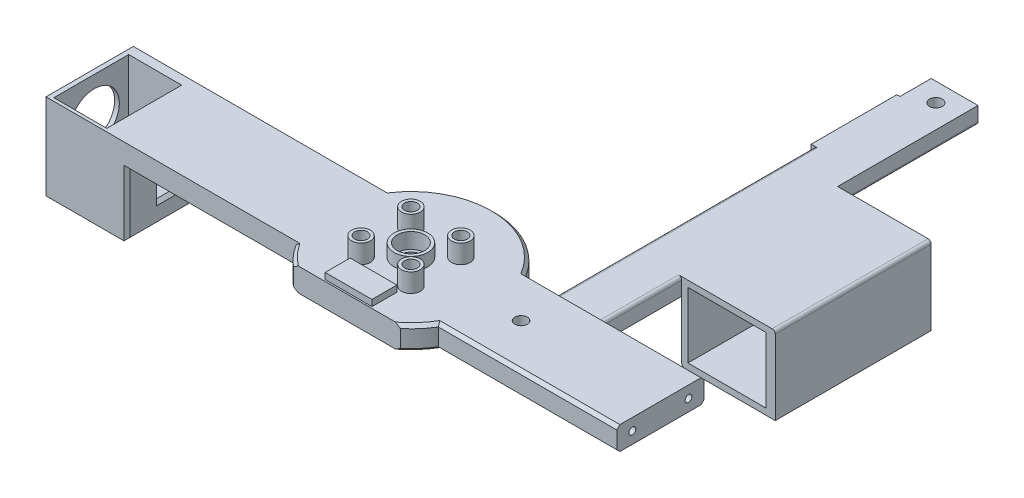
SolidWorks part; units mm, degrees
ref_plane "前视基准面" through (0, 0, 0) normal (0, 0, 1) x (1, 0, 0)
ref_plane "上视基准面" through (0, 0, 0) normal (0, 1, 0) x (1, 0, 0)
ref_plane "右视基准面" through (0, 0, 0) normal (1, 0, 0) x (0, 0, -1)
sketch "草图3" plane through (0, 0, 0) normal (0, 1, 0) x (1, 0, 0)
  line L0 (22.8017, 14) -> (50, 14)
  line L1 (-50, -14) -> (-22.8017, -14)
  line L3 (-50, 14) -> (-22.8017, 14)
  line L5 (-50, -14) -> (50, 14) construction
  line L6 (-50, 14) -> (50, -14) construction
  line L7 (22.8017, -14) -> (50, -14)
  line L9 (-50, 14) -> (-85, 14)
  line L10 (-50, -14) -> (-85, -14)
  line L11 (-85, 14) -> (-85, -14)
  line L13 (-85, 14) -> (-74.296, 14)
  line L14 (-85, 14) -> (-85, -14)
  line L15 (-85, -14) -> (-74.296, -14)
  line L17 (50, 14) -> (80, 14)
  line L19 (50, -14) -> (80, -14)
  line L24 (80, 14) -> (80, -14)
  arc A0 (-22.8017, -14) -> (22.8017, -14) centre (0, 0) ccw
  arc A1 (22.8017, 14) -> (-22.8017, 14) centre (0, 0) ccw
extrude "凸台-拉伸1" add sketch "草图3" along normal blind 7.5 contours L9 L3 A1 L0 L17 L24 L19 L7 A0 L1 L10 L11
sketch "草图4" plane through (0, 0, 0) normal (0, -1, 0) x (1, 0, 0)
  line L0 (-22.8017, -14) -> (-85, -14) construction
  line L1 (-85, 14) -> (-77, 14)
  line L2 (-85, 14) -> (-85, -14)
  line L3 (-85, -14) -> (-77, -14)
  line L4 (-77, 14) -> (-77, -14)
  dimension "D1" = 8
extrude "凸台-拉伸2" add sketch "草图4" along normal blind 20
sketch "草图7" plane through (-77, 0, 0) normal (1, 0, 0) x (0, 0, -1)
  line L0 (-3.5, -8.5) -> (3.5, -8.5)
  line L1 (-3.5, -8.5) -> (-3.5, -13.5)
  line L2 (3.5, -8.5) -> (3.5, -13.5)
  line L3 (-3.5, -13.5) -> (3.5, -13.5)
  line L4 (14, 0) -> (-14, 0) construction
  dimension "D1" = 8.5
  dimension "D2" = 5
extrude "切除-拉伸1" cut sketch "草图7" against normal blind 5
sketch "草图8" plane through (0, 7.5, 0) normal (0, 1, 0) x (1, 0, 0)
  circle A0 centre (0, 0) radius 4.4
extrude "切除-拉伸2" cut sketch "草图8" against normal blind 1 contours A0
sketch "草图9" plane through (0, 6.5, 0) normal (0, 1, 0) x (1, 0, 0)
  circle A0 centre (0, 0) radius 3.4
extrude "切除-拉伸3" cut sketch "草图9" against normal blind 8
sketch "草图14" plane through (80, 0, 0) normal (1, 0, 0) x (0, 0, -1)
  line L0 (0, 7.5) -> (0, 0)
  line L1 (14, 7.5) -> (-14, 7.5) construction
  line L2 (14, 0) -> (-14, 0) construction
  circle A0 centre (-9, 3.75) radius 1.1
  circle A1 centre (9, 3.75) radius 1.1
chamfer "倒角1" distance 1 angle 45 17 edges at (-49.9009, 0, -14) (0, 0, -26.7566) (51.4009, 0, -14) (51.4009, 0, 14) (0, 0, 26.7566) (-49.9009, 0, 14) (0, 7.5, 26.7566) (51.4009, 7.5, 14) (51.4009, 7.5, -14) (0, 7.5, -26.7566) (-77, -10, 14) (-77, -20, 0) (-77, -10, -14) (-77, -13.5, 0) (-77, -11, -3.5) (-77, -11, 3.5) (-77, -8.5, 0)
extrude "切除-拉伸6" cut sketch "草图14" against normal blind 4 contours A1 | A0
sketch "草图15" plane through (0, 0, 0) normal (0, -1, 0) x (1, 0, 0)
  circle A2 centre (-17, 0) radius 2
extrude "凸台-拉伸3" add sketch "草图15" along normal blind 2.5
sketch "草图16" plane through (0, 7.5, 0) normal (0, 1, 0) x (1, 0, 0)
  line L1 (-8, -8) -> (8, -8)
  line L2 (-8, -8) -> (-8, 8)
  line L3 (-8, 8) -> (8, 8)
  line L4 (8, -8) -> (8, 8)
  line L5 (-8, -8) -> (8, 8) construction
  line L6 (-8, 8) -> (8, -8) construction
  point P0 (0, 0)
  dimension "D1" = 16
  dimension "D2" = 16
sketch "草图17" plane through (0, 7.5, 0) normal (0, 1, 0) x (1, 0, 0)
  circle A0 centre (8, 8) radius 2.05
  circle A1 centre (-8, 8) radius 2.05
  circle A2 centre (-8, -8) radius 2.05
  circle A3 centre (8, -8) radius 2.05
  circle A4 centre (-8, 8) radius 3
  circle A5 centre (8, 8) radius 3
  circle A6 centre (-8, -8) radius 3
  circle A7 centre (8, -8) radius 3
extrude "凸台-拉伸4" add sketch "草图17" along normal blind 6
sketch "草图18" plane through (0, 7.5, 0) normal (0, 1, 0) x (1, 0, 0)
  circle A0 centre (0, 0) radius 4.4
  circle A1 centre (0, 0) radius 5.4
extrude "凸台-拉伸5" add sketch "草图18" along normal blind 4
sketch "草图19" plane through (0, 7.5, 0) normal (0, 1, 0) x (1, 0, 0)
  circle A0 centre (35.3025, 0) radius 2
extrude "切除-拉伸7" cut sketch "草图19" against normal blind 6
sketch "草图20" plane through (0, 7.5, 0) normal (0, 1, 0) x (1, 0, 0)
  line L1 (-7.5, -12) -> (7.5, -12)
  line L2 (-7.5, -12) -> (-7.5, -20)
  line L3 (-7.5, -20) -> (7.5, -20)
  line L4 (7.5, -12) -> (7.5, -20)
  line L5 (-7.5, -12) -> (7.5, -20) construction
  line L6 (-7.5, -20) -> (7.5, -12) construction
  point P0 (0, -16)
  dimension "D1" = 15
  dimension "D2" = 8
  dimension "D3" = 0
sketch "草图25" plane through (-85, 0, 0) normal (-1, 0, 0) x (0, 0, 1)
  line L0 (-14, 7.5) -> (14, 7.5) construction
  line L1 (14, 7.5) -> (14, -20) construction
  circle A0 centre (0, -4.5) radius 2.1
  dimension "D1" = 12
  dimension "D2" = 14
extrude "切除-拉伸9" cut sketch "草图25" against normal blind 5
sketch "草图26" plane through (-85, 0, 0) normal (-1, 0, 0) x (0, 0, 1)
  line L1 (-14, 7.5) -> (14, 7.5)
  line L2 (-14, 7.5) -> (-14, -20)
  line L3 (-14, -20) -> (14, -20)
  line L4 (14, 7.5) -> (14, -20)
extrude "凸台-拉伸10" add sketch "草图26" along normal blind 18
sketch "草图28" plane through (0, 0, -14) normal (0, 0, -1) x (-1, 0, 0)
  line L0 (103, 7.5) -> (21.6195, 7.5) construction
  line L1 (84.5, 7.5) -> (101.5, 7.5)
  line L2 (84.5, 7.5) -> (84.5, -20)
  line L3 (84.5, -20) -> (101.5, -20)
  line L4 (101.5, 7.5) -> (101.5, -20)
  line L5 (103, -20) -> (78, -20) construction
  line L6 (103, 7.5) -> (103, -20) construction
  dimension "D1" = 17
  dimension "D2" = 1.5
extrude "切除-拉伸10" cut sketch "草图28" against normal blind 27
sketch "草图29" plane through (-103, 0, 0) normal (-1, 0, 0) x (0, 0, 1)
  line L0 (14, -20) -> (14, 7.5) construction
  line L1 (14, 7.5) -> (-14, 7.5) construction
  circle A0 centre (0, -4.5) radius 8
  dimension "D1" = 14
  dimension "D2" = 12
extrude "切除-拉伸11" cut sketch "草图29" against normal blind 3
sketch "草图42" plane through (0, 7.5, 0) normal (0, 1, 0) x (1, 0, 0)
  line L1 (-29.8362, -32.5182) -> (33.5963, -32.5182)
  line L2 (-29.8362, -32.5182) -> (-29.8362, -20.5182)
  line L3 (-29.8362, -20.5182) -> (33.5963, -20.5182)
  line L4 (33.5963, -32.5182) -> (33.5963, -20.5182)
extrude "切除-拉伸15" cut sketch "草图42" against normal blind 10
sketch "草图43" plane through (-84.5, 0, 0) normal (-1, 0, 0) x (0, 0, 1)
  line L0 (-14, -20) -> (14, -20) construction
  line L1 (-14, 7.5) -> (-11, 7.5)
  line L2 (-14, 7.5) -> (-14, -20)
  line L3 (-14, -20) -> (-11, -20)
  line L4 (-11, 7.5) -> (-11, -20)
  dimension "D1" = 3
extrude "凸台-拉伸16" add sketch "草图43" along normal blind 18.5
sketch "草图44" plane through (0, 0, -14) normal (0, 0, -1) x (-1, 0, 0)
  line L1 (-47.8017, 6.5) -> (-32.8017, 6.5)
  line L2 (-47.8017, 6.5) -> (-47.8017, 1)
  line L3 (-47.8017, 1) -> (-32.8017, 1)
  line L4 (-32.8017, 6.5) -> (-32.8017, 1)
  line L5 (-80, 1) -> (-22.8017, 1) construction
  line L7 (-22.8017, 6.5) -> (-22.8017, 1) construction
  dimension "D1" = 10
  dimension "D2" = 15
extrude "凸台-拉伸17" add sketch "草图44" along normal blind 120
sketch "草图45" plane through (47.8017, 0, 0) normal (1, 0, 0) x (0, 0, -1)
  line L0 (134, 6.5) -> (14, 6.5) construction
  line L1 (39, 6.5) -> (89, 6.5)
  line L2 (39, 6.5) -> (39, -18.5)
  line L3 (39, -18.5) -> (89, -18.5)
  line L4 (89, 6.5) -> (89, -18.5)
  line L5 (14, 6.5) -> (14, 1) construction
  dimension "D1" = 50
  dimension "D2" = 25
  dimension "D3" = 25
extrude "凸台-拉伸18" add sketch "草图45" along normal blind 30
sketch "草图46" plane through (0, 0, -39) normal (0, 0, 1) x (1, 0, 0)
  line L0 (77.8017, 6.5) -> (77.8017, -18.5) construction
  line L1 (74.8017, -16.5) -> (49.8017, -16.5)
  line L2 (74.8017, -16.5) -> (74.8017, 4.5)
  line L3 (74.8017, 4.5) -> (49.8017, 4.5)
  line L4 (49.8017, -16.5) -> (49.8017, 4.5)
  line L5 (77.8017, -18.5) -> (47.8017, -18.5) construction
  line L6 (47.8017, 1) -> (47.8017, -18.5) construction
  line L7 (22.2352, 7.5) -> (80, 7.5) construction
  dimension "D1" = 3
  dimension "D2" = 2
  dimension "D3" = 2
  dimension "D4" = 3
extrude "切除-拉伸16" cut sketch "草图46" against normal blind 50
sketch "草图48" plane through (32.8017, 0, 0) normal (-1, 0, 0) x (0, 0, 1)
  line L0 (-134, 6.5) -> (-14, 6.5) construction
  line L1 (-124, 6.5) -> (-96.5, 6.5)
  line L2 (-124, 6.5) -> (-124, 1)
  line L3 (-124, 1) -> (-96.5, 1)
  line L4 (-96.5, 6.5) -> (-96.5, 1)
  line L5 (-134, 1) -> (-14, 1) construction
  line L6 (-134, 1) -> (-134, 6.5) construction
  dimension "D1" = 27.5
  dimension "D2" = 10
extrude "凸台-拉伸19" add sketch "草图48" along normal blind 1
sketch "草图49" plane through (0, 6.5, 0) normal (0, 1, 0) x (1, 0, 0)
  line L0 (47.8017, 134) -> (47.8017, 89) construction
  line L2 (32.8017, 134) -> (47.8017, 134) construction
  circle A0 centre (40.3017, 128) radius 2.05
  dimension "D1" = 7.5
  dimension "D2" = 6
extrude "切除-拉伸17" cut sketch "草图49" against normal blind 10
sketch "草图50" plane through (0, 1, 0) normal (0, -1, 0) x (1, 0, 0)
  circle A0 centre (40.3017, -128) radius 3.5
extrude "切除-拉伸18" cut sketch "草图50" against normal blind 2.6
fillet "圆角5" radius 1 6 edges at (47.8017, 6.5, -26.5) (47.8017, 1, -111.5) (32.8017, 6.5, -55.25) (31.8017, 1, -110.25) (47.8017, -18.5, -64) (77.8017, 6.5, -64)
extrude "凸台-拉伸20" add sketch "草图20" along normal blind 2
